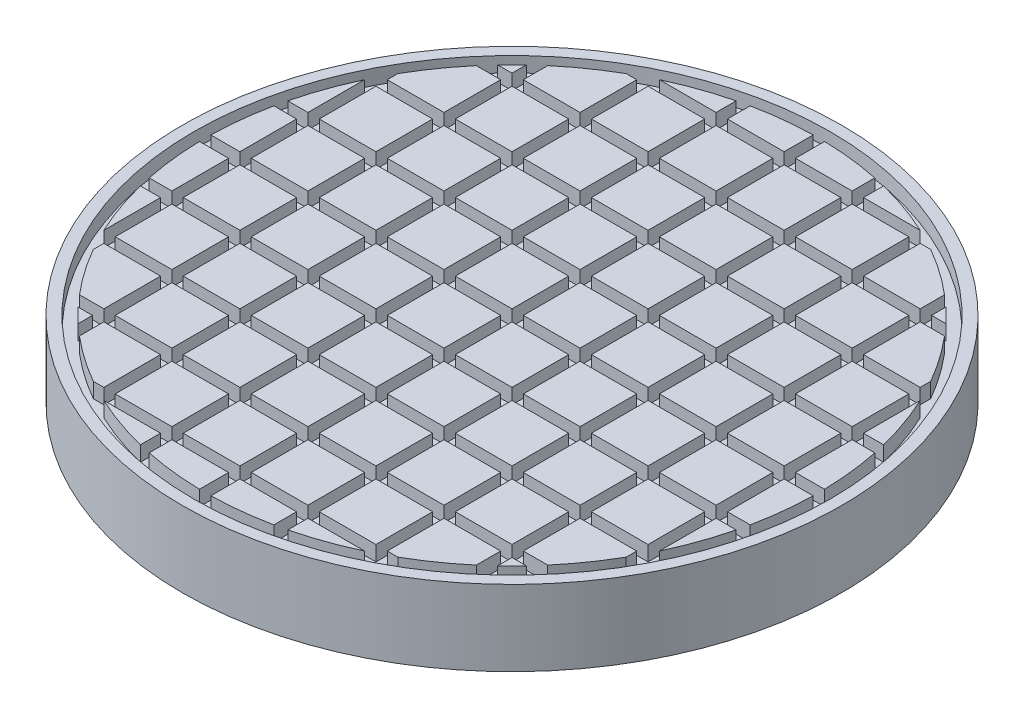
SolidWorks part; units mm, degrees
ref_plane "Front Plane" through (0, 0, 0) normal (0, 0, 1) x (1, 0, 0)
ref_plane "Top Plane" through (0, 0, 0) normal (0, 1, 0) x (1, 0, 0)
ref_plane "Right Plane" through (0, 0, 0) normal (1, 0, 0) x (0, 0, -1)
sketch "Sketch1" plane through (0, 0, 0) normal (0, 1, 0) x (1, 0, 0)
  circle A0 centre (0, 0) radius 87.2
extrude "Boss-Extrude1" add sketch "Sketch1" along normal mid plane 20
sketch "Sketch3" plane through (0, 10, 0) normal (0, 1, 0) x (1, 0, 0)
  line L0 (-150.5372, 0) -> (150.5372, 0) construction
  line L1 (0, 105.3211) -> (0, -105.3211) construction
  line L2 (-1.5, 81.1861) -> (-1.5, 1.5) construction
  line L3 (-1.5, 1.5) -> (-81.1861, 1.5) construction
  line L4 (-1.5, 1.5) -> (-1.5, 16.5)
  line L5 (-1.5, 1.5) -> (-16.5, 1.5)
  line L6 (-1.5, 16.5) -> (-16.5, 16.5)
  line L7 (-16.5, 1.5) -> (-16.5, 16.5)
  line L8 (-19.5, 16.5) -> (-34.5, 16.5)
  line L9 (-19.5, 1.5) -> (-34.5, 1.5)
  line L10 (-19.5, 1.5) -> (-19.5, 16.5)
  line L11 (-34.5, 1.5) -> (-34.5, 16.5)
  line L12 (-37.5, 16.5) -> (-52.5, 16.5)
  line L13 (-37.5, 1.5) -> (-52.5, 1.5)
  line L14 (-37.5, 1.5) -> (-37.5, 16.5)
  line L15 (-52.5, 1.5) -> (-52.5, 16.5)
  line L16 (-55.5, 16.5) -> (-70.5, 16.5)
  line L17 (-55.5, 1.5) -> (-70.5, 1.5)
  line L18 (-55.5, 1.5) -> (-55.5, 16.5)
  line L19 (-70.5, 1.5) -> (-70.5, 16.5)
  line L20 (-73.5, 16.5) -> (-88.5, 16.5)
  line L21 (-73.5, 1.5) -> (-88.5, 1.5)
  line L22 (-73.5, 1.5) -> (-73.5, 16.5)
  line L23 (-88.5, 1.5) -> (-88.5, 16.5)
  line L24 (-19.5, 34.5) -> (-34.5, 34.5)
  line L25 (-19.5, 19.5) -> (-34.5, 19.5)
  line L26 (-19.5, 19.5) -> (-19.5, 34.5)
  line L27 (-34.5, 19.5) -> (-34.5, 34.5)
  line L28 (-37.5, 34.5) -> (-52.5, 34.5)
  line L29 (-37.5, 19.5) -> (-52.5, 19.5)
  line L30 (-37.5, 19.5) -> (-37.5, 34.5)
  line L31 (-52.5, 19.5) -> (-52.5, 34.5)
  line L32 (-55.5, 34.5) -> (-70.5, 34.5)
  line L33 (-55.5, 19.5) -> (-70.5, 19.5)
  line L34 (-55.5, 19.5) -> (-55.5, 34.5)
  line L35 (-70.5, 19.5) -> (-70.5, 34.5)
  line L36 (-73.5, 34.5) -> (-88.5, 34.5)
  line L37 (-73.5, 19.5) -> (-88.5, 19.5)
  line L38 (-73.5, 19.5) -> (-73.5, 34.5)
  line L39 (-88.5, 19.5) -> (-88.5, 34.5)
  line L40 (-19.5, 52.5) -> (-34.5, 52.5)
  line L41 (-19.5, 37.5) -> (-34.5, 37.5)
  line L42 (-19.5, 37.5) -> (-19.5, 52.5)
  line L43 (-34.5, 37.5) -> (-34.5, 52.5)
  line L44 (-37.5, 52.5) -> (-52.5, 52.5)
  line L45 (-37.5, 37.5) -> (-52.5, 37.5)
  line L46 (-37.5, 37.5) -> (-37.5, 52.5)
  line L47 (-52.5, 37.5) -> (-52.5, 52.5)
  line L48 (-55.5, 52.5) -> (-70.5, 52.5)
  line L49 (-55.5, 37.5) -> (-70.5, 37.5)
  line L50 (-55.5, 37.5) -> (-55.5, 52.5)
  line L51 (-70.5, 37.5) -> (-70.5, 52.5)
  line L52 (-73.5, 52.5) -> (-88.5, 52.5)
  line L53 (-73.5, 37.5) -> (-88.5, 37.5)
  line L54 (-73.5, 37.5) -> (-73.5, 52.5)
  line L55 (-88.5, 37.5) -> (-88.5, 52.5)
  line L56 (-19.5, 70.5) -> (-34.5, 70.5)
  line L57 (-19.5, 55.5) -> (-34.5, 55.5)
  line L58 (-19.5, 55.5) -> (-19.5, 70.5)
  line L59 (-34.5, 55.5) -> (-34.5, 70.5)
  line L60 (-37.5, 70.5) -> (-52.5, 70.5)
  line L61 (-37.5, 55.5) -> (-52.5, 55.5)
  line L62 (-37.5, 55.5) -> (-37.5, 70.5)
  line L63 (-52.5, 55.5) -> (-52.5, 70.5)
  line L64 (-55.5, 70.5) -> (-70.5, 70.5)
  line L65 (-55.5, 55.5) -> (-70.5, 55.5)
  line L66 (-55.5, 55.5) -> (-55.5, 70.5)
  line L67 (-70.5, 55.5) -> (-70.5, 70.5)
  line L68 (-73.5, 70.5) -> (-88.5, 70.5)
  line L69 (-73.5, 55.5) -> (-88.5, 55.5)
  line L70 (-73.5, 55.5) -> (-73.5, 70.5)
  line L71 (-88.5, 55.5) -> (-88.5, 70.5)
  line L72 (-19.5, 88.5) -> (-34.5, 88.5)
  line L73 (-19.5, 73.5) -> (-34.5, 73.5)
  line L74 (-19.5, 73.5) -> (-19.5, 88.5)
  line L75 (-34.5, 73.5) -> (-34.5, 88.5)
  line L76 (-37.5, 88.5) -> (-52.5, 88.5)
  line L77 (-37.5, 73.5) -> (-52.5, 73.5)
  line L78 (-37.5, 73.5) -> (-37.5, 88.5)
  line L79 (-52.5, 73.5) -> (-52.5, 88.5)
  line L80 (-55.5, 88.5) -> (-70.5, 88.5)
  line L81 (-55.5, 73.5) -> (-70.5, 73.5)
  line L82 (-55.5, 73.5) -> (-55.5, 88.5)
  line L83 (-70.5, 73.5) -> (-70.5, 88.5)
  line L84 (-73.5, 88.5) -> (-88.5, 88.5)
  line L85 (-73.5, 73.5) -> (-88.5, 73.5)
  line L86 (-73.5, 73.5) -> (-73.5, 88.5)
  line L87 (-88.5, 73.5) -> (-88.5, 88.5)
  line L88 (-1.5, 34.5) -> (-16.5, 34.5)
  line L89 (-1.5, 19.5) -> (-16.5, 19.5)
  line L90 (-1.5, 19.5) -> (-1.5, 34.5)
  line L91 (-16.5, 19.5) -> (-16.5, 34.5)
  line L92 (-1.5, 52.5) -> (-16.5, 52.5)
  line L93 (-1.5, 37.5) -> (-16.5, 37.5)
  line L94 (-1.5, 37.5) -> (-1.5, 52.5)
  line L95 (-16.5, 37.5) -> (-16.5, 52.5)
  line L96 (-1.5, 70.5) -> (-16.5, 70.5)
  line L97 (-1.5, 55.5) -> (-16.5, 55.5)
  line L98 (-1.5, 55.5) -> (-1.5, 70.5)
  line L99 (-16.5, 55.5) -> (-16.5, 70.5)
  line L100 (-1.5, 88.5) -> (-16.5, 88.5)
  line L101 (-1.5, 73.5) -> (-16.5, 73.5)
  line L102 (-1.5, 73.5) -> (-1.5, 88.5)
  line L103 (-16.5, 73.5) -> (-16.5, 88.5)
  line L104 (73.5, 1.5) -> (73.5, 16.5)
  line L105 (73.5, 1.5) -> (88.5, 1.5)
  line L106 (88.5, 1.5) -> (88.5, 16.5)
  line L107 (73.5, 16.5) -> (88.5, 16.5)
  line L108 (55.5, 1.5) -> (55.5, 16.5)
  line L109 (55.5, 1.5) -> (70.5, 1.5)
  line L110 (70.5, 1.5) -> (70.5, 16.5)
  line L111 (55.5, 16.5) -> (70.5, 16.5)
  line L112 (37.5, 1.5) -> (37.5, 16.5)
  line L113 (37.5, 1.5) -> (52.5, 1.5)
  line L114 (52.5, 1.5) -> (52.5, 16.5)
  line L115 (37.5, 16.5) -> (52.5, 16.5)
  line L116 (19.5, 1.5) -> (19.5, 16.5)
  line L117 (19.5, 1.5) -> (34.5, 1.5)
  line L118 (34.5, 1.5) -> (34.5, 16.5)
  line L119 (19.5, 16.5) -> (34.5, 16.5)
  line L120 (37.5, 19.5) -> (37.5, 34.5)
  line L121 (37.5, 19.5) -> (52.5, 19.5)
  line L122 (52.5, 19.5) -> (52.5, 34.5)
  line L123 (37.5, 34.5) -> (52.5, 34.5)
  line L124 (19.5, 19.5) -> (19.5, 34.5)
  line L125 (19.5, 19.5) -> (34.5, 19.5)
  line L126 (34.5, 19.5) -> (34.5, 34.5)
  line L127 (19.5, 34.5) -> (34.5, 34.5)
  line L128 (19.5, 37.5) -> (19.5, 52.5)
  line L129 (19.5, 37.5) -> (34.5, 37.5)
  line L130 (34.5, 37.5) -> (34.5, 52.5)
  line L131 (19.5, 52.5) -> (34.5, 52.5)
  line L132 (37.5, 37.5) -> (37.5, 52.5)
  line L133 (37.5, 37.5) -> (52.5, 37.5)
  line L134 (52.5, 37.5) -> (52.5, 52.5)
  line L135 (37.5, 52.5) -> (52.5, 52.5)
  line L136 (55.5, 37.5) -> (55.5, 52.5)
  line L137 (55.5, 37.5) -> (70.5, 37.5)
  line L138 (70.5, 37.5) -> (70.5, 52.5)
  line L139 (55.5, 52.5) -> (70.5, 52.5)
  line L140 (55.5, 19.5) -> (55.5, 34.5)
  line L141 (55.5, 19.5) -> (70.5, 19.5)
  line L142 (70.5, 19.5) -> (70.5, 34.5)
  line L143 (55.5, 34.5) -> (70.5, 34.5)
  line L144 (73.5, 19.5) -> (73.5, 34.5)
  line L145 (73.5, 19.5) -> (88.5, 19.5)
  line L146 (88.5, 19.5) -> (88.5, 34.5)
  line L147 (73.5, 34.5) -> (88.5, 34.5)
  line L148 (73.5, 37.5) -> (73.5, 52.5)
  line L149 (73.5, 37.5) -> (88.5, 37.5)
  line L150 (88.5, 37.5) -> (88.5, 52.5)
  line L151 (73.5, 52.5) -> (88.5, 52.5)
  line L152 (55.5, 55.5) -> (55.5, 70.5)
  line L153 (55.5, 55.5) -> (70.5, 55.5)
  line L154 (70.5, 55.5) -> (70.5, 70.5)
  line L155 (55.5, 70.5) -> (70.5, 70.5)
  line L156 (37.5, 55.5) -> (37.5, 70.5)
  line L157 (37.5, 55.5) -> (52.5, 55.5)
  line L158 (52.5, 55.5) -> (52.5, 70.5)
  line L159 (37.5, 70.5) -> (52.5, 70.5)
  line L160 (19.5, 55.5) -> (19.5, 70.5)
  line L161 (19.5, 55.5) -> (34.5, 55.5)
  line L162 (34.5, 55.5) -> (34.5, 70.5)
  line L163 (19.5, 70.5) -> (34.5, 70.5)
  line L164 (37.5, 73.5) -> (37.5, 88.5)
  line L165 (37.5, 73.5) -> (52.5, 73.5)
  line L166 (52.5, 73.5) -> (52.5, 88.5)
  line L167 (37.5, 88.5) -> (52.5, 88.5)
  line L168 (19.5, 73.5) -> (19.5, 88.5)
  line L169 (19.5, 73.5) -> (34.5, 73.5)
  line L170 (34.5, 73.5) -> (34.5, 88.5)
  line L171 (19.5, 88.5) -> (34.5, 88.5)
  line L172 (1.5, 73.5) -> (1.5, 88.5)
  line L173 (1.5, 73.5) -> (16.5, 73.5)
  line L174 (16.5, 73.5) -> (16.5, 88.5)
  line L175 (1.5, 88.5) -> (16.5, 88.5)
  line L176 (1.5, 55.5) -> (1.5, 70.5)
  line L177 (1.5, 55.5) -> (16.5, 55.5)
  line L178 (16.5, 55.5) -> (16.5, 70.5)
  line L179 (1.5, 70.5) -> (16.5, 70.5)
  line L180 (1.5, 37.5) -> (1.5, 52.5)
  line L181 (1.5, 37.5) -> (16.5, 37.5)
  line L182 (16.5, 37.5) -> (16.5, 52.5)
  line L183 (1.5, 52.5) -> (16.5, 52.5)
  line L184 (1.5, 19.5) -> (1.5, 34.5)
  line L185 (1.5, 19.5) -> (16.5, 19.5)
  line L186 (16.5, 19.5) -> (16.5, 34.5)
  line L187 (1.5, 34.5) -> (16.5, 34.5)
  line L188 (1.5, 16.5) -> (16.5, 16.5)
  line L189 (16.5, 1.5) -> (16.5, 16.5)
  line L190 (1.5, 1.5) -> (16.5, 1.5)
  line L191 (1.5, 1.5) -> (1.5, 16.5)
  line L192 (-73.5, -1.5) -> (-73.5, -16.5)
  line L193 (-73.5, -1.5) -> (-88.5, -1.5)
  line L194 (-88.5, -1.5) -> (-88.5, -16.5)
  line L195 (-73.5, -16.5) -> (-88.5, -16.5)
  line L196 (-73.5, -19.5) -> (-73.5, -34.5)
  line L197 (-73.5, -19.5) -> (-88.5, -19.5)
  line L198 (-88.5, -19.5) -> (-88.5, -34.5)
  line L199 (-73.5, -34.5) -> (-88.5, -34.5)
  line L200 (-73.5, -37.5) -> (-73.5, -52.5)
  line L201 (-73.5, -37.5) -> (-88.5, -37.5)
  line L202 (-88.5, -37.5) -> (-88.5, -52.5)
  line L203 (-73.5, -52.5) -> (-88.5, -52.5)
  line L204 (-55.5, -55.5) -> (-55.5, -70.5)
  line L205 (-55.5, -55.5) -> (-70.5, -55.5)
  line L206 (-70.5, -55.5) -> (-70.5, -70.5)
  line L207 (-55.5, -70.5) -> (-70.5, -70.5)
  line L208 (-55.5, -37.5) -> (-55.5, -52.5)
  line L209 (-55.5, -37.5) -> (-70.5, -37.5)
  line L210 (-70.5, -37.5) -> (-70.5, -52.5)
  line L211 (-55.5, -52.5) -> (-70.5, -52.5)
  line L212 (-55.5, -19.5) -> (-55.5, -34.5)
  line L213 (-55.5, -19.5) -> (-70.5, -19.5)
  line L214 (-70.5, -19.5) -> (-70.5, -34.5)
  line L215 (-55.5, -34.5) -> (-70.5, -34.5)
  line L216 (-55.5, -1.5) -> (-55.5, -16.5)
  line L217 (-55.5, -1.5) -> (-70.5, -1.5)
  line L218 (-70.5, -1.5) -> (-70.5, -16.5)
  line L219 (-55.5, -16.5) -> (-70.5, -16.5)
  line L220 (-37.5, -1.5) -> (-37.5, -16.5)
  line L221 (-37.5, -1.5) -> (-52.5, -1.5)
  line L222 (-52.5, -1.5) -> (-52.5, -16.5)
  line L223 (-37.5, -16.5) -> (-52.5, -16.5)
  line L224 (-37.5, -19.5) -> (-37.5, -34.5)
  line L225 (-37.5, -19.5) -> (-52.5, -19.5)
  line L226 (-52.5, -19.5) -> (-52.5, -34.5)
  line L227 (-37.5, -34.5) -> (-52.5, -34.5)
  line L228 (-37.5, -37.5) -> (-37.5, -52.5)
  line L229 (-37.5, -37.5) -> (-52.5, -37.5)
  line L230 (-52.5, -37.5) -> (-52.5, -52.5)
  line L231 (-37.5, -52.5) -> (-52.5, -52.5)
  line L232 (-37.5, -55.5) -> (-37.5, -70.5)
  line L233 (-37.5, -55.5) -> (-52.5, -55.5)
  line L234 (-52.5, -55.5) -> (-52.5, -70.5)
  line L235 (-37.5, -70.5) -> (-52.5, -70.5)
  line L236 (-37.5, -73.5) -> (-37.5, -88.5)
  line L237 (-37.5, -73.5) -> (-52.5, -73.5)
  line L238 (-52.5, -73.5) -> (-52.5, -88.5)
  line L239 (-37.5, -88.5) -> (-52.5, -88.5)
  line L240 (-19.5, -73.5) -> (-19.5, -88.5)
  line L241 (-19.5, -73.5) -> (-34.5, -73.5)
  line L242 (-34.5, -73.5) -> (-34.5, -88.5)
  line L243 (-19.5, -88.5) -> (-34.5, -88.5)
  line L244 (-19.5, -55.5) -> (-19.5, -70.5)
  line L245 (-19.5, -55.5) -> (-34.5, -55.5)
  line L246 (-34.5, -55.5) -> (-34.5, -70.5)
  line L247 (-19.5, -70.5) -> (-34.5, -70.5)
  line L248 (-19.5, -37.5) -> (-19.5, -52.5)
  line L249 (-19.5, -37.5) -> (-34.5, -37.5)
  line L250 (-34.5, -37.5) -> (-34.5, -52.5)
  line L251 (-19.5, -52.5) -> (-34.5, -52.5)
  line L252 (-19.5, -19.5) -> (-19.5, -34.5)
  line L253 (-19.5, -19.5) -> (-34.5, -19.5)
  line L254 (-34.5, -19.5) -> (-34.5, -34.5)
  line L255 (-19.5, -34.5) -> (-34.5, -34.5)
  line L256 (-19.5, -1.5) -> (-19.5, -16.5)
  line L257 (-19.5, -1.5) -> (-34.5, -1.5)
  line L258 (-34.5, -1.5) -> (-34.5, -16.5)
  line L259 (-19.5, -16.5) -> (-34.5, -16.5)
  line L260 (-1.5, -16.5) -> (-16.5, -16.5)
  line L261 (-16.5, -1.5) -> (-16.5, -16.5)
  line L262 (-1.5, -1.5) -> (-16.5, -1.5)
  line L263 (-1.5, -1.5) -> (-1.5, -16.5)
  line L264 (-1.5, -19.5) -> (-1.5, -34.5)
  line L265 (-1.5, -19.5) -> (-16.5, -19.5)
  line L266 (-16.5, -19.5) -> (-16.5, -34.5)
  line L267 (-1.5, -34.5) -> (-16.5, -34.5)
  line L268 (-1.5, -37.5) -> (-1.5, -52.5)
  line L269 (-1.5, -37.5) -> (-16.5, -37.5)
  line L270 (-16.5, -37.5) -> (-16.5, -52.5)
  line L271 (-1.5, -52.5) -> (-16.5, -52.5)
  line L272 (-1.5, -55.5) -> (-1.5, -70.5)
  line L273 (-1.5, -55.5) -> (-16.5, -55.5)
  line L274 (-16.5, -55.5) -> (-16.5, -70.5)
  line L275 (-1.5, -70.5) -> (-16.5, -70.5)
  line L276 (-1.5, -73.5) -> (-1.5, -88.5)
  line L277 (-1.5, -73.5) -> (-16.5, -73.5)
  line L278 (-16.5, -73.5) -> (-16.5, -88.5)
  line L279 (-1.5, -88.5) -> (-16.5, -88.5)
  line L280 (1.5, -73.5) -> (16.5, -73.5)
  line L281 (16.5, -73.5) -> (16.5, -88.5)
  line L282 (1.5, -88.5) -> (16.5, -88.5)
  line L283 (1.5, -73.5) -> (1.5, -88.5)
  line L284 (1.5, -55.5) -> (16.5, -55.5)
  line L285 (16.5, -55.5) -> (16.5, -70.5)
  line L286 (1.5, -70.5) -> (16.5, -70.5)
  line L287 (1.5, -55.5) -> (1.5, -70.5)
  line L288 (1.5, -37.5) -> (16.5, -37.5)
  line L289 (16.5, -37.5) -> (16.5, -52.5)
  line L290 (1.5, -52.5) -> (16.5, -52.5)
  line L291 (1.5, -37.5) -> (1.5, -52.5)
  line L292 (1.5, -19.5) -> (16.5, -19.5)
  line L293 (16.5, -19.5) -> (16.5, -34.5)
  line L294 (1.5, -34.5) -> (16.5, -34.5)
  line L295 (1.5, -19.5) -> (1.5, -34.5)
  line L296 (1.5, -1.5) -> (1.5, -16.5)
  line L297 (1.5, -1.5) -> (16.5, -1.5)
  line L298 (16.5, -1.5) -> (16.5, -16.5)
  line L299 (1.5, -16.5) -> (16.5, -16.5)
  line L300 (19.5, -1.5) -> (34.5, -1.5)
  line L301 (34.5, -1.5) -> (34.5, -16.5)
  line L302 (19.5, -16.5) -> (34.5, -16.5)
  line L303 (19.5, -1.5) -> (19.5, -16.5)
  line L304 (19.5, -19.5) -> (34.5, -19.5)
  line L305 (34.5, -19.5) -> (34.5, -34.5)
  line L306 (19.5, -34.5) -> (34.5, -34.5)
  line L307 (19.5, -19.5) -> (19.5, -34.5)
  line L308 (19.5, -37.5) -> (34.5, -37.5)
  line L309 (34.5, -37.5) -> (34.5, -52.5)
  line L310 (19.5, -52.5) -> (34.5, -52.5)
  line L311 (19.5, -37.5) -> (19.5, -52.5)
  line L312 (19.5, -55.5) -> (34.5, -55.5)
  line L313 (34.5, -55.5) -> (34.5, -70.5)
  line L314 (19.5, -70.5) -> (34.5, -70.5)
  line L315 (19.5, -55.5) -> (19.5, -70.5)
  line L316 (19.5, -73.5) -> (34.5, -73.5)
  line L317 (34.5, -73.5) -> (34.5, -88.5)
  line L318 (19.5, -88.5) -> (34.5, -88.5)
  line L319 (19.5, -73.5) -> (19.5, -88.5)
  line L320 (37.5, -73.5) -> (52.5, -73.5)
  line L321 (52.5, -73.5) -> (52.5, -88.5)
  line L322 (37.5, -88.5) -> (52.5, -88.5)
  line L323 (37.5, -73.5) -> (37.5, -88.5)
  line L324 (37.5, -55.5) -> (52.5, -55.5)
  line L325 (52.5, -55.5) -> (52.5, -70.5)
  line L326 (37.5, -70.5) -> (52.5, -70.5)
  line L327 (37.5, -55.5) -> (37.5, -70.5)
  line L328 (37.5, -37.5) -> (52.5, -37.5)
  line L329 (52.5, -37.5) -> (52.5, -52.5)
  line L330 (37.5, -52.5) -> (52.5, -52.5)
  line L331 (37.5, -37.5) -> (37.5, -52.5)
  line L332 (37.5, -19.5) -> (52.5, -19.5)
  line L333 (52.5, -19.5) -> (52.5, -34.5)
  line L334 (37.5, -34.5) -> (52.5, -34.5)
  line L335 (37.5, -19.5) -> (37.5, -34.5)
  line L336 (37.5, -1.5) -> (52.5, -1.5)
  line L337 (52.5, -1.5) -> (52.5, -16.5)
  line L338 (37.5, -16.5) -> (52.5, -16.5)
  line L339 (37.5, -1.5) -> (37.5, -16.5)
  line L340 (55.5, -1.5) -> (70.5, -1.5)
  line L341 (70.5, -1.5) -> (70.5, -16.5)
  line L342 (55.5, -16.5) -> (70.5, -16.5)
  line L343 (55.5, -1.5) -> (55.5, -16.5)
  line L344 (55.5, -19.5) -> (70.5, -19.5)
  line L345 (70.5, -19.5) -> (70.5, -34.5)
  line L346 (55.5, -34.5) -> (70.5, -34.5)
  line L347 (55.5, -19.5) -> (55.5, -34.5)
  line L348 (55.5, -37.5) -> (70.5, -37.5)
  line L349 (70.5, -37.5) -> (70.5, -52.5)
  line L350 (55.5, -52.5) -> (70.5, -52.5)
  line L351 (55.5, -37.5) -> (55.5, -52.5)
  line L352 (55.5, -55.5) -> (70.5, -55.5)
  line L353 (70.5, -55.5) -> (70.5, -70.5)
  line L354 (55.5, -70.5) -> (70.5, -70.5)
  line L355 (55.5, -55.5) -> (55.5, -70.5)
  line L356 (73.5, -37.5) -> (88.5, -37.5)
  line L357 (88.5, -37.5) -> (88.5, -52.5)
  line L358 (73.5, -52.5) -> (88.5, -52.5)
  line L359 (73.5, -37.5) -> (73.5, -52.5)
  line L360 (73.5, -19.5) -> (88.5, -19.5)
  line L361 (88.5, -19.5) -> (88.5, -34.5)
  line L362 (73.5, -34.5) -> (88.5, -34.5)
  line L363 (73.5, -19.5) -> (73.5, -34.5)
  line L364 (73.5, -1.5) -> (88.5, -1.5)
  line L365 (88.5, -1.5) -> (88.5, -16.5)
  line L366 (73.5, -16.5) -> (88.5, -16.5)
  line L367 (73.5, -1.5) -> (73.5, -16.5)
  circle A0 centre (0, 0) radius 84.2
  circle A1 centre (0, 0) radius 87.2 construction
  circle A2 centre (0, 0) radius 87.2
  circle A3 centre (0, 0) radius 81.2
  point P8 (0, 0)
  point P11 (0, 0)
extrude "Cut-Extrude1" cut sketch "Sketch3" against normal blind 4 contours A3 L48 A0 L51 | A3 L51 A0 L54 L53 L36 | L281 A3 L319 L316 L317 L326 L327 L324 L325 L355 L352 L350 L351 L348 L349 L362 L363 L360 L366 L367 L364 L105 L104 L107 L145 L144 L147 L138 L137 L136 L139 L153 L152 L158 L157 L156 L159 L170 L169 L168 | A3 L103 A0 L74 | A3 L74 A0 L75 | A3 L60 A0 L63 | A3 L63 A0 L66 | A3 L66 A0 L65 | A3 L65 A0 L48 | A3 L36 A0 L37 | L54 A0 L53 | A3 L37 A0 L20 | A3 L20 A0 L21 | A3 L21 A0 L193 | A3 L193 A0 L195 | A3 L75 A0 L78 L77 L60 | L78 A0 L77 | A3 L102 A0 L103 | A3 L172 A0 L102 | A3 L174 A0 L172 | A3 L168 A0 L174 | A3 L170 A0 L168 | A3 L159 A0 L165 L164 L170 | L165 A0 L164 | A3 L158 A0 L159 | A3 L152 A0 L158 | A3 L153 A0 L152 | A3 L139 A0 L153 | A3 L138 A0 L139 | A3 L147 A0 L149 L148 L138 | L149 A0 L148 | A3 L145 A0 L147 | A3 L107 A0 L145 | A3 L105 A0 L107 | A3 L364 A0 L105 | A3 L366 A0 L364 | A3 L360 A0 L366 | A3 L362 A0 L360 | L359 A0 L356 | A3 L349 A0 L359 L356 L362 | A3 L350 A0 L349 | A3 L352 A0 L350 | A3 L355 A0 L352 | A3 L325 A0 L355 | A3 L326 A0 L325 | A3 L317 A0 L323 L320 L326 | L323 A0 L320 | A3 L319 A0 L317 | A3 L281 A0 L319 | A3 L283 A0 L281 | A3 L276 A0 L283 | A3 L278 A0 L276 | A3 L240 A0 L278 | A3 L242 A0 L240 | A3 L235 A0 L237 L236 L242 | L237 A0 L236 | A3 L234 A0 L235 | A3 L204 A0 L234 | A3 L205 A0 L204 | A3 L211 A0 L205 | A3 L210 A0 L211 | A3 L195 A0 L197 | A3 L197 A0 L199 | A3 L199 A0 L201 L200 L210 | L201 A0 L200
equation "\"PlateDiameter\" = 174.4"
equation "\"GrooveGap\"= 3"
equation "\"SquareSize\"= 15"
equation "\"D1@Sketch1\"=\"PlateDiameter\""
equation "\"D1@Sketch3\"=\"PlateDiameter\"-(\"GrooveGap\" *2)"
equation "\"D2@Sketch3\"=\"PlateDiameter\"-(\"GrooveGap\"*4)"
equation "\"D3@Sketch3\"=\"GrooveGap\"/2"
equation "\"D4@Sketch3\"=\"GrooveGap\"/2"
equation "\"D5@Sketch3\"=\"SquareSize\""
equation "\"D6@Sketch3\"=\"SquareSize\""
